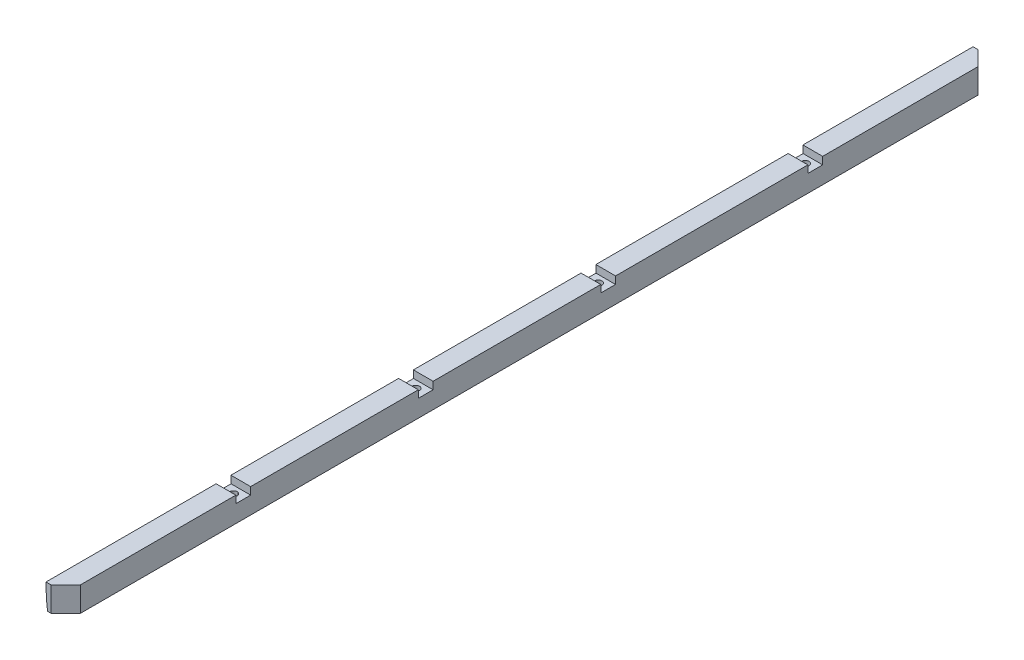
SolidWorks part; units mm, degrees
other "<Rail, 47in, Two Battery Nose>-<Cut-Extrude1>"
ref_plane "Front Plane" through (0, 0, 0) normal (0, 0, 1) x (1, 0, 0)
ref_plane "Top Plane" through (0, 0, 0) normal (0, 1, 0) x (1, 0, 0)
ref_plane "Right Plane" through (0, 0, 0) normal (1, 0, 0) x (0, 0, -1)
ref_plane "Plane1-Rail, 47in, Two Battery Nose_Mirrored" through (469.9, 0, 0) normal (0, 0, 1) x (-1, 0, 0)
ref_plane "Plane2-Rail, 47in, Two Battery Nose_Mirrored" through (469.9, 0, 0) normal (0, 1, 0) x (-1, 0, 0)
ref_plane "Plane3-Rail, 47in, Two Battery Nose_Mirrored" through (469.9, 0, 0) normal (-1, 0, 0) x (0, 0, -1)
mirrored part "Rail, 47in, Two Battery Nose_Mirrored"
